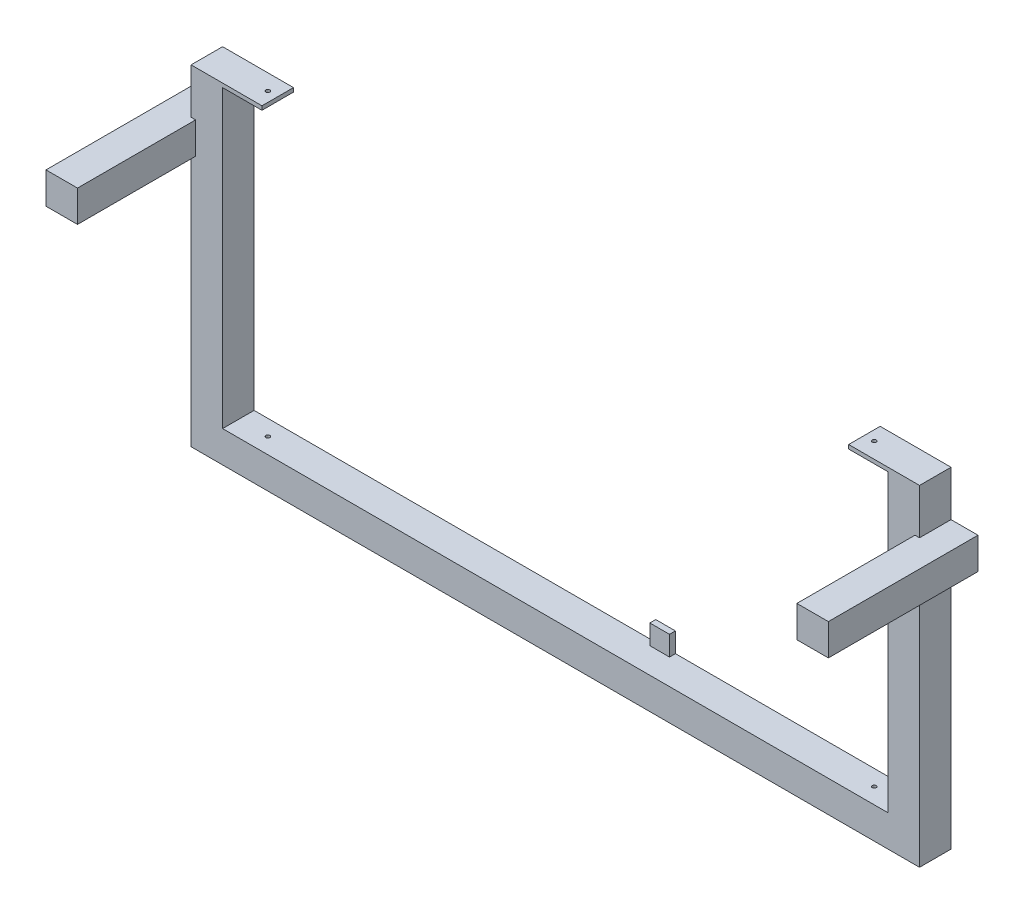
SolidWorks part; units mm, degrees
ref_plane "Face" through (0, 0, 0) normal (0, 0, 1) x (1, 0, 0)
ref_plane "Dessus" through (0, 0, 0) normal (0, 1, 0) x (1, 0, 0)
ref_plane "Droite" through (0, 0, 0) normal (1, 0, 0) x (0, 0, -1)
sketch "Esquisse1" plane through (0, 0, 0) normal (0, 0, 1) x (1, 0, 0)
  line L0 (925, 40) -> (-925, -40) construction
  line L1 (-925, 40) -> (925, 40)
  line L2 (-925, 40) -> (-925, -40)
  line L3 (-925, -40) -> (925, -40)
  line L4 (925, 40) -> (925, -40)
  dimension "D1" = 80
  dimension "D2" = 1850
extrude "Base-Extrusion" add sketch "Esquisse1" along normal mid plane 80
sketch "Esquisse2" plane through (0, 40, 0) normal (0, 1, 0) x (-1, 0, 0)
  line L0 (-925, -40) -> (925, -40) construction
  line L1 (925, 40) -> (845, 40)
  line L2 (925, 40) -> (925, -40)
  line L3 (925, -40) -> (845, -40)
  line L4 (845, 40) -> (845, -40)
  line L5 (-925, 40) -> (925, 40) construction
  line L6 (-925, -40) -> (-845, -40)
  line L7 (-925, -40) -> (-925, 40)
  line L8 (-925, 40) -> (-845, 40)
  line L9 (-845, -40) -> (-845, 40)
extrude "Boss.-Extru.1" add sketch "Esquisse2" along normal blind 750
sketch "Esquisse3" plane through (0, 790, 0) normal (0, 1, 0) x (-1, 0, 0)
  line L1 (-925, 40) -> (-745, 40)
  line L2 (-925, 40) -> (-925, -40)
  line L3 (-925, -40) -> (-745, -40)
  line L4 (-745, 40) -> (-745, -40)
  line L5 (925, -40) -> (745, -40)
  line L6 (925, -40) -> (925, 40)
  line L7 (925, 40) -> (745, 40)
  line L8 (745, -40) -> (745, 40)
  dimension "D1" = 1490
extrude "Boss.-Extru.2" add sketch "Esquisse3" along normal blind 10
sketch "Esquisse4" plane through (0, 800, 0) normal (0, 1, 0) x (-1, 0, 0)
  line L0 (-770, 0) -> (770, 0) construction
  circle A0 centre (-770, 0) radius 5
  circle A1 centre (770, 0) radius 5
  dimension "D1" = 10
  dimension "D2" = 1540
extrude "Enlèv. mat.-Extru.1" cut sketch "Esquisse4" against normal through all
sketch "Esquisse5" plane through (0, 0, -40) normal (0, 0, -1) x (-1, 0, 0)
  line L1 (993.5, 684.76) -> (913.5, 684.76)
  line L2 (993.5, 684.76) -> (993.5, 604.76)
  line L3 (993.5, 604.76) -> (913.5, 604.76)
  line L4 (913.5, 684.76) -> (913.5, 604.76)
  line L6 (770, 800) -> (770, 743.4512) construction
  line L7 (775, 800) -> (765, 800) construction
  line L9 (745, 790) -> (845, 790) construction
  line L10 (0, 0) -> (0, 322.4651) construction
  line L11 (-913.5, 684.76) -> (-913.5, 604.76)
  line L12 (-993.5, 604.76) -> (-913.5, 604.76)
  line L13 (-993.5, 684.76) -> (-993.5, 604.76)
  line L14 (-993.5, 684.76) -> (-913.5, 684.76)
  dimension "D1" = 143.5
  dimension "D2" = 80
  dimension "D3" = 105.24
extrude "Boss.-Extru.3" add sketch "Esquisse5" against normal blind 380
sketch "Esquisse6" plane through (0, 40, 0) normal (0, 1, 0) x (-1, 0, 0)
  line L0 (-925, 40) -> (-925, -40) construction
  line L1 (-225, -40) -> (-175, -40)
  line L2 (-225, -40) -> (-225, -25)
  line L3 (-225, -25) -> (-175, -25)
  line L4 (-175, -40) -> (-175, -25)
  line L5 (-845, -40) -> (845, -40) construction
  dimension "D1" = 700
  dimension "D2" = 50
  dimension "D3" = 15
extrude "Boss.-Extru.4" add sketch "Esquisse6" along normal blind 50
